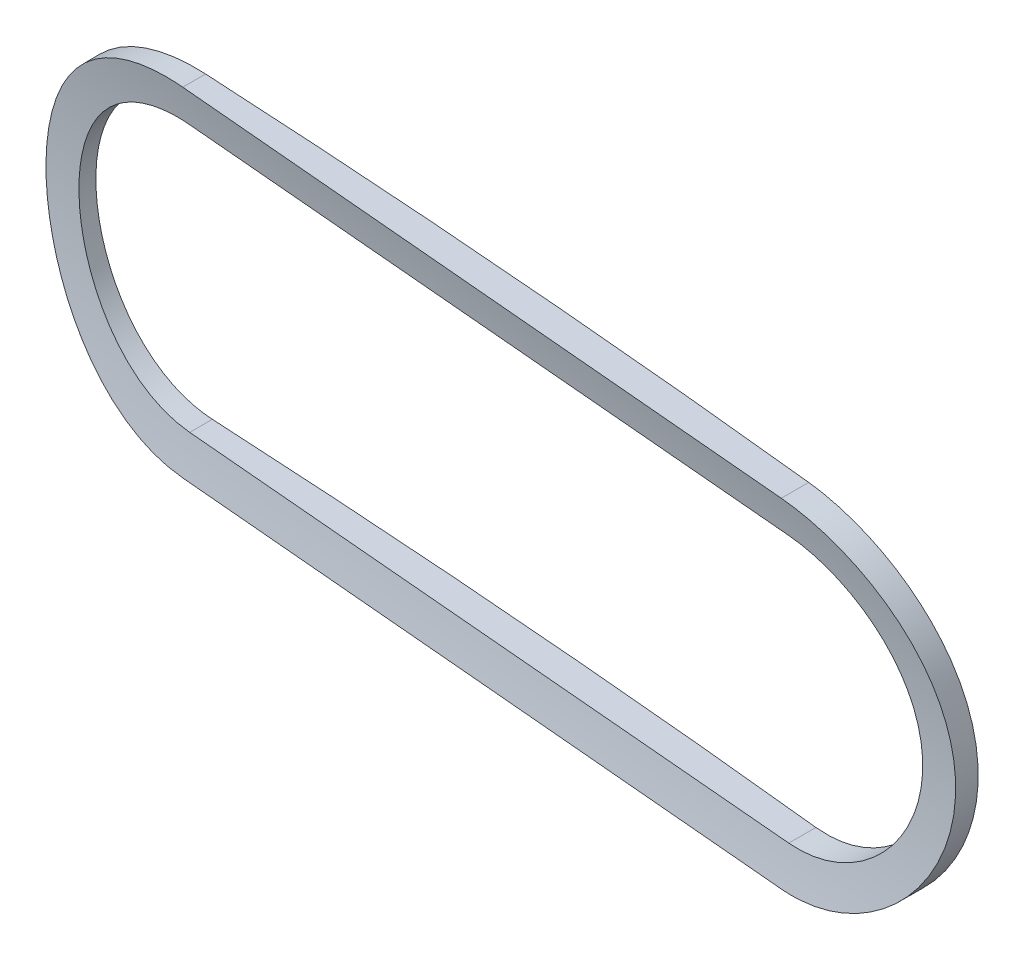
SolidWorks part; units mm, degrees
ref_plane "Front Plane" through (0, 0, 0) normal (0, 0, 1) x (1, 0, 0)
ref_plane "Top Plane" through (0, 0, 0) normal (0, 1, 0) x (1, 0, 0)
ref_plane "Right Plane" through (0, 0, 0) normal (1, 0, 0) x (0, 0, -1)
sketch "Sketch1" plane through (0, 0, 0) normal (0, 0, 1) x (1, 0, 0)
  line L0 (172.2437, 29.3688) -> (316.7062, 29.3688) construction
  line L1 (172.2437, 29.3688) -> (316.7062, 29.3688)
  line L2 (172.2437, -29.3688) -> (316.7062, -29.3688)
  line L3 (172.2437, 37.3063) -> (316.7062, 37.3063)
  line L4 (172.2437, -37.3063) -> (316.7062, -37.3063)
  arc A2 (172.2437, 29.3688) -> (172.2437, -29.3688) centre (172.2437, 0) ccw construction
  arc A3 (172.2437, 29.3688) -> (172.2437, -29.3688) centre (172.2437, 0) ccw
  arc A4 (316.7062, 29.3688) -> (316.7062, -29.3688) centre (316.7062, 0) cw
  arc A5 (316.7062, 37.3063) -> (316.7062, -37.3063) centre (316.7062, 0) cw
  arc A6 (172.2437, 37.3063) -> (172.2437, -37.3063) centre (172.2437, 0) ccw
  dimension "D1" = 7.9375
extrude "Boss-Extrude1" add sketch "Sketch1" against normal up to surface (167.1002 mm away)
sketch "Sketch2" plane through (0, 0, 0) normal (0, 1, 0) x (-1, 0, 0)
  line L1 (-133.35, 32.9888) -> (-384.9404, 32.9888)
  line L2 (-133.35, 32.9888) -> (-133.35, -168.275)
  line L3 (-133.35, -168.275) -> (-384.9404, -150.6821)
  line L4 (-384.9404, 32.9888) -> (-384.9404, -150.6821)
  dimension "D1" = 168.275
  dimension "D2" = 4
  dimension "D3" = 133.35
extrude "Cut-Extrude2" cut sketch "Sketch2" along normal through all both and the other way through all
sketch "Sketch3" plane through (0, 0, 0) normal (0, -1, 0) x (1, 0, 0)
  line L0 (0, 0) -> (-24.4303, 0) construction
  line L1 (-90.8226, 0) -> (224.5009, 0) construction
  line L2 (366.7125, -159.5438) -> (131.7625, -179.3875)
  line L3 (131.7625, -179.3875) -> (131.7625, -98.0465)
  line L4 (131.7625, -98.0465) -> (366.7125, -95.4077)
  line L5 (366.7125, -95.4077) -> (366.7125, -159.5438)
  dimension "D1" = 131.7625
  dimension "D2" = 179.3875
  dimension "D3" = 159.5438
  dimension "D4" = 234.95
revolve "Cut-Revolve1" cut sketch "Sketch3" angle 360 about L0
equation "\"Buoyancy\"=\"SW-Volume\"*(\"SW-Density\"-.037062)"
equation "\"Air Weight\"= \"SW-Mass\""
